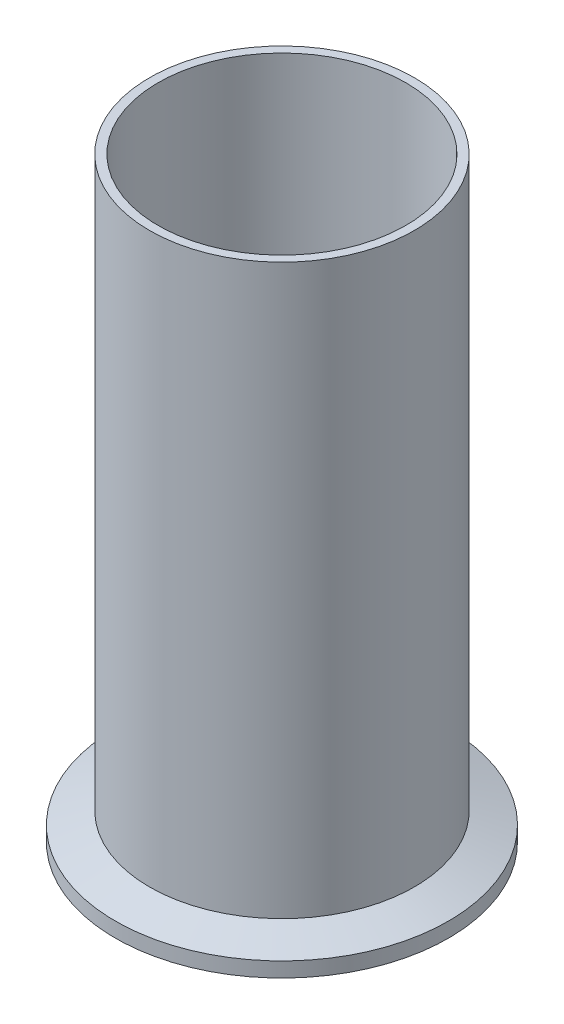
SolidWorks part; units mm, degrees
ref_plane "Front Plane" through (0, 0, 0) normal (0, 0, 1) x (1, 0, 0)
ref_plane "Top Plane" through (0, 0, 0) normal (0, 1, 0) x (1, 0, 0)
ref_plane "Right Plane" through (0, 0, 0) normal (1, 0, 0) x (0, 0, -1)
sketch "Sketch1" plane through (0, 0, 0) normal (0, 0, 1) x (1, 0, 0)
  line L0 (0, 0) -> (0, 114.3) construction
  line L1 (0, 114.3) -> (-25.4, 114.3)
  line L2 (-25.4, 114.3) -> (-25.4, 5.23)
  line L3 (-25.4, 5.23) -> (-31.9532, 2.8448)
  line L4 (-31.9532, 2.8448) -> (-31.9532, 0)
  line L5 (-31.9532, 0) -> (-29.9866, 0)
  line L6 (-26.3506, 0) -> (0, 0)
  line L7 (0, 0) -> (0, 114.3)
  line L8 (0, 114.3) -> (-23.749, 114.3)
  line L9 (-23.749, 114.3) -> (-23.749, 0)
  line L10 (-23.749, 0) -> (0, 0)
  line L11 (0, 0) -> (-0.1846, 0.0129)
  arc A0 (-29.2641, 0.4745) -> (-27.0731, 0.4745) centre (-28.1686, 0) cw
  arc A1 (-26.3506, 0) -> (-27.0731, 0.4745) centre (-26.3506, 0.7874) cw
  arc A2 (-29.2641, 0.4745) -> (-29.9866, 0) centre (-29.9866, 0.7874) cw
  point P12 (-26.9748, 0)
  dimension "D6" = 1.1938
  dimension "D7" = 0.7874
  dimension "D1" = 25.4
  dimension "D2" = 2.8448
  dimension "D3" = 31.9532
  dimension "D4" = 70
  dimension "D5" = 28.1686
  dimension "D8" = 1.651
  dimension "D9" = 114.3
revolve "Revolve2" add sketch "Sketch1" angle 360 about L0
